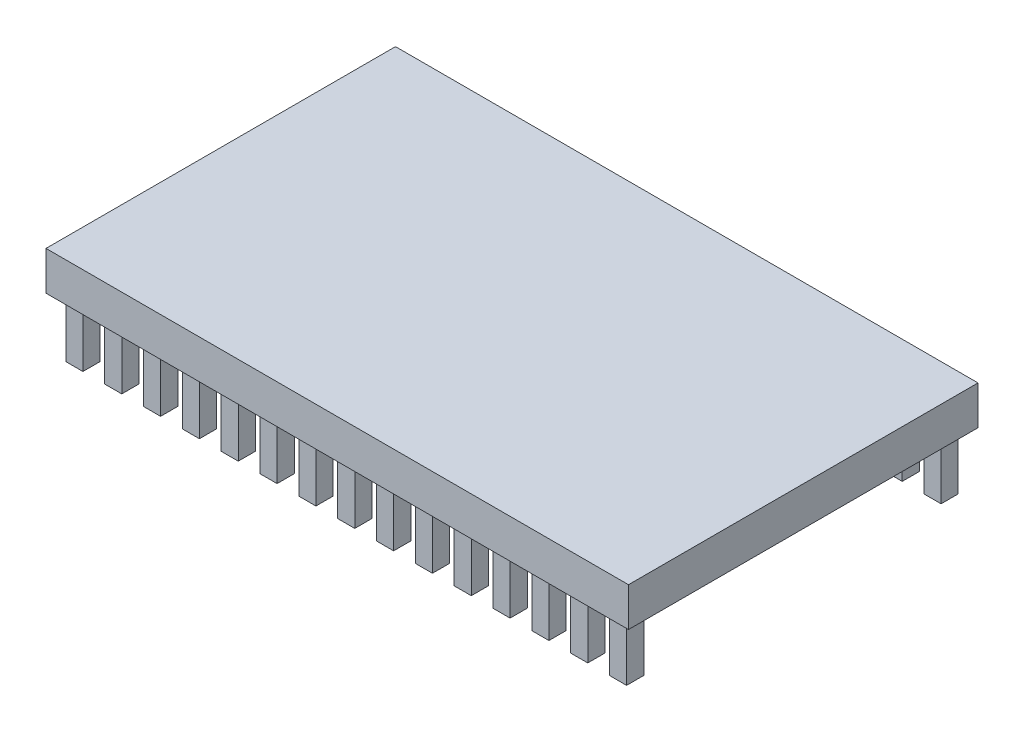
SolidWorks part; units mm, degrees
ref_plane "Front Plane" through (0, 0, 0) normal (0, 0, 1) x (1, 0, 0)
ref_plane "Top Plane" through (0, 0, 0) normal (0, 1, 0) x (1, 0, 0)
ref_plane "Right Plane" through (0, 0, 0) normal (1, 0, 0) x (0, 0, -1)
sketch "Sketch1" plane through (0, 0, 0) normal (0, 1, 0) x (1, 0, 0)
  line L1 (-15, -9) -> (15, -9)
  line L2 (-15, -9) -> (-15, 9)
  line L3 (-15, 9) -> (15, 9)
  line L4 (15, -9) -> (15, 9)
  line L5 (-15, -9) -> (15, 9) construction
  line L6 (-15, 9) -> (15, -9) construction
  point P0 (0, 0)
  dimension "D1" = 30
  dimension "D2" = 18
extrude "Boss-Extrude1" add sketch "Sketch1" along normal blind 2
sketch "Sketch2" plane through (0, 0, 0) normal (0, -1, 0) x (1, 0, 0)
  line L0 (-16.6257, 0) -> (19.9534, 0) construction
  line L1 (-14.442, 8.5403) -> (-13.558, 8.5403)
  line L2 (-14.442, 8.5403) -> (-14.442, 7.6564)
  line L3 (-14.442, 7.6564) -> (-13.558, 7.6564)
  line L4 (-13.558, 8.5403) -> (-13.558, 7.6564)
  line L5 (-14.442, 8.5403) -> (-13.558, 7.6564) construction
  line L6 (-14.442, 7.6564) -> (-13.558, 8.5403) construction
  line L7 (-12.442, 8.5403) -> (-11.558, 8.5403)
  line L8 (-12.442, 8.5403) -> (-12.442, 7.6564)
  line L9 (-12.442, 7.6564) -> (-11.558, 7.6564)
  line L10 (-11.558, 8.5403) -> (-11.558, 7.6564)
  line L11 (-10.442, 8.5403) -> (-9.558, 8.5403)
  line L12 (-10.442, 8.5403) -> (-10.442, 7.6564)
  line L13 (-10.442, 7.6564) -> (-9.558, 7.6564)
  line L14 (-9.558, 8.5403) -> (-9.558, 7.6564)
  line L15 (-8.442, 8.5403) -> (-7.558, 8.5403)
  line L16 (-8.442, 8.5403) -> (-8.442, 7.6564)
  line L17 (-8.442, 7.6564) -> (-7.558, 7.6564)
  line L18 (-7.558, 8.5403) -> (-7.558, 7.6564)
  line L19 (-6.442, 8.5403) -> (-5.558, 8.5403)
  line L20 (-6.442, 8.5403) -> (-6.442, 7.6564)
  line L21 (-6.442, 7.6564) -> (-5.558, 7.6564)
  line L22 (-5.558, 8.5403) -> (-5.558, 7.6564)
  line L23 (-4.442, 8.5403) -> (-3.558, 8.5403)
  line L24 (-4.442, 8.5403) -> (-4.442, 7.6564)
  line L25 (-4.442, 7.6564) -> (-3.558, 7.6564)
  line L26 (-3.558, 8.5403) -> (-3.558, 7.6564)
  line L27 (-2.442, 8.5403) -> (-1.558, 8.5403)
  line L28 (-2.442, 8.5403) -> (-2.442, 7.6564)
  line L29 (-2.442, 7.6564) -> (-1.558, 7.6564)
  line L30 (-1.558, 8.5403) -> (-1.558, 7.6564)
  line L31 (-0.442, 8.5403) -> (0.442, 8.5403)
  line L32 (-0.442, 8.5403) -> (-0.442, 7.6564)
  line L33 (-0.442, 7.6564) -> (0.442, 7.6564)
  line L34 (0.442, 8.5403) -> (0.442, 7.6564)
  line L35 (1.558, 8.5403) -> (2.442, 8.5403)
  line L36 (1.558, 8.5403) -> (1.558, 7.6564)
  line L37 (1.558, 7.6564) -> (2.442, 7.6564)
  line L38 (2.442, 8.5403) -> (2.442, 7.6564)
  line L39 (3.558, 8.5403) -> (4.442, 8.5403)
  line L40 (3.558, 8.5403) -> (3.558, 7.6564)
  line L41 (3.558, 7.6564) -> (4.442, 7.6564)
  line L42 (4.442, 8.5403) -> (4.442, 7.6564)
  line L43 (5.558, 8.5403) -> (6.442, 8.5403)
  line L44 (5.558, 8.5403) -> (5.558, 7.6564)
  line L45 (5.558, 7.6564) -> (6.442, 7.6564)
  line L46 (6.442, 8.5403) -> (6.442, 7.6564)
  line L47 (7.558, 8.5403) -> (8.442, 8.5403)
  line L48 (7.558, 8.5403) -> (7.558, 7.6564)
  line L49 (7.558, 7.6564) -> (8.442, 7.6564)
  line L50 (8.442, 8.5403) -> (8.442, 7.6564)
  line L51 (9.558, 8.5403) -> (10.442, 8.5403)
  line L52 (9.558, 8.5403) -> (9.558, 7.6564)
  line L53 (9.558, 7.6564) -> (10.442, 7.6564)
  line L54 (10.442, 8.5403) -> (10.442, 7.6564)
  line L55 (11.558, 8.5403) -> (12.442, 8.5403)
  line L56 (11.558, 8.5403) -> (11.558, 7.6564)
  line L57 (11.558, 7.6564) -> (12.442, 7.6564)
  line L58 (12.442, 8.5403) -> (12.442, 7.6564)
  line L59 (13.558, 8.5403) -> (14.442, 8.5403)
  line L60 (13.558, 8.5403) -> (13.558, 7.6564)
  line L61 (13.558, 7.6564) -> (14.442, 7.6564)
  line L62 (14.442, 8.5403) -> (14.442, 7.6564)
  line L63 (-15, -9) -> (-15, 9) construction
  line L64 (13.558, 8.5403) -> (14.442, 7.6564) construction
  line L65 (13.558, 7.6564) -> (14.442, 8.5403) construction
  line L66 (15, 9) -> (15, -9) construction
  line L67 (-1.558, -8.5403) -> (-1.558, -7.6564)
  line L68 (-2.442, -7.6564) -> (-1.558, -7.6564)
  line L69 (-2.442, -8.5403) -> (-2.442, -7.6564)
  line L70 (-2.442, -8.5403) -> (-1.558, -8.5403)
  line L71 (-3.558, -8.5403) -> (-3.558, -7.6564)
  line L72 (-4.442, -7.6564) -> (-3.558, -7.6564)
  line L73 (-4.442, -8.5403) -> (-4.442, -7.6564)
  line L74 (-4.442, -8.5403) -> (-3.558, -8.5403)
  line L75 (-5.558, -8.5403) -> (-5.558, -7.6564)
  line L76 (-6.442, -7.6564) -> (-5.558, -7.6564)
  line L77 (13.558, -7.6564) -> (14.442, -8.5403) construction
  line L78 (13.558, -8.5403) -> (14.442, -7.6564) construction
  line L79 (14.442, -8.5403) -> (14.442, -7.6564)
  line L80 (13.558, -7.6564) -> (14.442, -7.6564)
  line L81 (13.558, -8.5403) -> (13.558, -7.6564)
  line L82 (13.558, -8.5403) -> (14.442, -8.5403)
  line L83 (12.442, -8.5403) -> (12.442, -7.6564)
  line L84 (11.558, -7.6564) -> (12.442, -7.6564)
  line L85 (11.558, -8.5403) -> (11.558, -7.6564)
  line L86 (11.558, -8.5403) -> (12.442, -8.5403)
  line L87 (10.442, -8.5403) -> (10.442, -7.6564)
  line L88 (9.558, -7.6564) -> (10.442, -7.6564)
  line L89 (9.558, -8.5403) -> (9.558, -7.6564)
  line L90 (9.558, -8.5403) -> (10.442, -8.5403)
  line L91 (8.442, -8.5403) -> (8.442, -7.6564)
  line L92 (7.558, -7.6564) -> (8.442, -7.6564)
  line L93 (7.558, -8.5403) -> (7.558, -7.6564)
  line L94 (7.558, -8.5403) -> (8.442, -8.5403)
  line L95 (6.442, -8.5403) -> (6.442, -7.6564)
  line L96 (5.558, -7.6564) -> (6.442, -7.6564)
  line L97 (5.558, -8.5403) -> (5.558, -7.6564)
  line L98 (5.558, -8.5403) -> (6.442, -8.5403)
  line L99 (4.442, -8.5403) -> (4.442, -7.6564)
  line L100 (3.558, -7.6564) -> (4.442, -7.6564)
  line L101 (3.558, -8.5403) -> (3.558, -7.6564)
  line L102 (3.558, -8.5403) -> (4.442, -8.5403)
  line L103 (2.442, -8.5403) -> (2.442, -7.6564)
  line L104 (1.558, -7.6564) -> (2.442, -7.6564)
  line L105 (1.558, -8.5403) -> (1.558, -7.6564)
  line L106 (1.558, -8.5403) -> (2.442, -8.5403)
  line L107 (0.442, -8.5403) -> (0.442, -7.6564)
  line L108 (-0.442, -7.6564) -> (0.442, -7.6564)
  line L109 (-0.442, -8.5403) -> (-0.442, -7.6564)
  line L110 (-0.442, -8.5403) -> (0.442, -8.5403)
  line L111 (-6.442, -8.5403) -> (-6.442, -7.6564)
  line L112 (-6.442, -8.5403) -> (-5.558, -8.5403)
  line L113 (-14.442, -7.6564) -> (-13.558, -8.5403) construction
  line L114 (-14.442, -8.5403) -> (-13.558, -7.6564) construction
  line L115 (-7.558, -8.5403) -> (-7.558, -7.6564)
  line L116 (-8.442, -7.6564) -> (-7.558, -7.6564)
  line L117 (-8.442, -8.5403) -> (-8.442, -7.6564)
  line L118 (-8.442, -8.5403) -> (-7.558, -8.5403)
  line L119 (-9.558, -8.5403) -> (-9.558, -7.6564)
  line L120 (-10.442, -7.6564) -> (-9.558, -7.6564)
  line L121 (-10.442, -8.5403) -> (-10.442, -7.6564)
  line L122 (-10.442, -8.5403) -> (-9.558, -8.5403)
  line L123 (-11.558, -8.5403) -> (-11.558, -7.6564)
  line L124 (-12.442, -7.6564) -> (-11.558, -7.6564)
  line L125 (-12.442, -8.5403) -> (-12.442, -7.6564)
  line L126 (-12.442, -8.5403) -> (-11.558, -8.5403)
  line L127 (-13.558, -8.5403) -> (-13.558, -7.6564)
  line L128 (-14.442, -7.6564) -> (-13.558, -7.6564)
  line L129 (-14.442, -8.5403) -> (-14.442, -7.6564)
  line L130 (-14.442, -8.5403) -> (-13.558, -8.5403)
  point P0 (-14, 8.0984)
  point P66 (14, 8.0984)
  point P129 (-14, -8.0984)
  dimension "D2" = 1
  dimension "D3" = 1
  dimension "D1" = 15
extrude "Boss-Extrude2" add sketch "Sketch2" along normal blind 3
